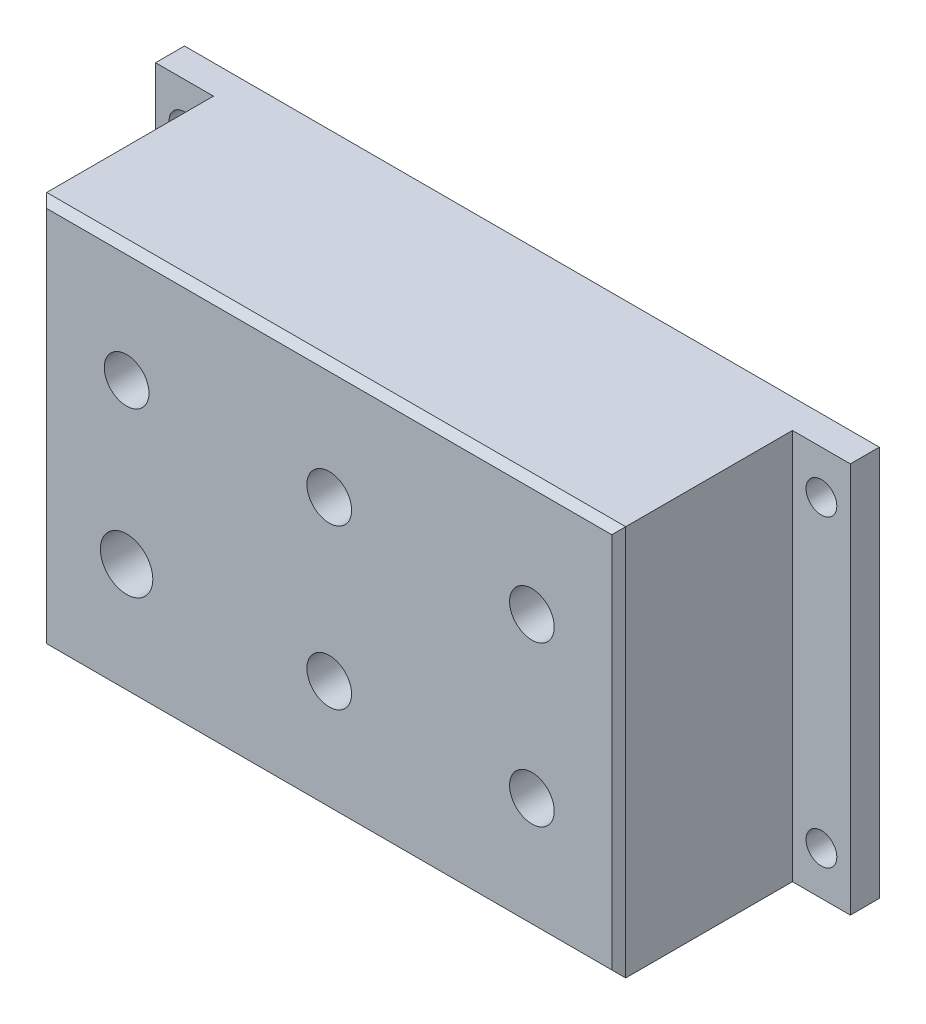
SolidWorks part; units mm, degrees
ref_plane "Front Plane" through (0, 0, 0) normal (0, 0, 1) x (1, 0, 0)
ref_plane "Top Plane" through (0, 0, 0) normal (0, 1, 0) x (1, 0, 0)
ref_plane "Right Plane" through (0, 0, 0) normal (1, 0, 0) x (0, 0, -1)
sketch "Sketch1" plane through (0, 0, 0) normal (0, 0, 1) x (1, 0, 0)
  line L1 (0, 0) -> (152.4, 0)
  line L2 (0, 0) -> (0, 85.725)
  line L3 (0, 85.725) -> (152.4, 85.725)
  line L4 (152.4, 0) -> (152.4, 85.725)
  dimension "D1" = 152.4
  dimension "D2" = 85.725
extrude "body" add sketch "Sketch1" along normal blind 44.45
sketch "Sketch3" plane through (0, 0, 44.45) normal (0, 0, 1) x (1, 0, 0)
  line L0 (0, 0) -> (152.4, 0) construction
  line L1 (0, 85.725) -> (12.7, 85.725)
  line L2 (0, 85.725) -> (0, 0)
  line L3 (0, 0) -> (12.7, 0)
  line L4 (12.7, 85.725) -> (12.7, 0)
  line L6 (152.4, 85.725) -> (139.7, 85.725)
  line L7 (152.4, 85.725) -> (152.4, 0)
  line L8 (152.4, 0) -> (139.7, 0)
  line L9 (139.7, 85.725) -> (139.7, 0)
  dimension "D1" = 12.7
  dimension "D2" = 12.7
extrude "ears" cut sketch "Sketch3" against normal blind 38.1
sketch "Sketch4" plane through (0, 0, 6.35) normal (0, 0, 1) x (1, 0, 0)
  line L0 (146.05, 85.725) -> (146.05, -7.6292) construction
  line L1 (152.4, 85.725) -> (139.7, 85.725) construction
  line L2 (6.35, 85.725) -> (6.35, -3.103) construction
  line L3 (12.7, 85.725) -> (0, 85.725) construction
  line L4 (-8.9064, 76.2) -> (161.3064, 76.2) construction
  line L5 (-8.9064, 9.525) -> (159.9348, 9.525) construction
  circle A0 centre (6.35, 76.2) radius 3.3782
  circle A1 centre (6.35, 9.525) radius 3.3782
  circle A2 centre (146.05, 9.525) radius 3.3782
  circle A3 centre (146.05, 76.2) radius 3.3782
  dimension "D3" = 6.7564
  dimension "D4" = 6.7564
  dimension "D5" = 6.7564
  dimension "D6" = 6.7564
  dimension "D1" = 9.525
  dimension "D2" = 66.675
extrude "mount holes" cut sketch "Sketch4" against normal through all
sketch "Sketch5" plane through (0, 0, 44.45) normal (0, 0, 1) x (1, 0, 0)
  line L0 (-8.7692, 60.325) -> (159.1119, 60.325) construction
  line L1 (-10.4151, 25.4) -> (159.1119, 25.4) construction
  line L2 (139.7, 85.725) -> (12.7, 85.725) construction
  line L3 (12.7, 0) -> (139.7, 0) construction
  line L4 (0, 42.8625) -> (159.1119, 42.8625) construction
  line L5 (0, 85.725) -> (0, 0) construction
  line L6 (31.75, 108.9549) -> (31.75, 11.5729) construction
  line L7 (53.975, 108.9549) -> (53.975, 13.6303) construction
  line L8 (76.2, 108.9549) -> (76.2, 13.3559) construction
  line L9 (98.425, 108.9549) -> (98.425, 11.5729) construction
  line L10 (12.7, 0) -> (12.7, 85.725) construction
  line L11 (120.65, 107.0347) -> (120.65, 11.5729) construction
  line L12 (139.7, 85.725) -> (139.7, 0) construction
  circle A0 centre (31.75, 25.4) radius 5.7531
  circle A2 centre (76.2, 25.4) radius 4.9022
  circle A4 centre (31.75, 60.325) radius 4.9022
  circle A5 centre (76.2, 60.325) radius 4.9022
  circle A6 centre (120.65, 60.325) radius 4.9022
  circle A7 centre (120.65, 25.4) radius 4.9022
  dimension "D9" = 9.8044
  dimension "D11" = 11.5062
  dimension "D12" = 9.8044
  dimension "D13" = 9.8044
  dimension "D15" = 9.8044
  dimension "D16" = 9.8044
  dimension "D1" = 25.4
  dimension "D2" = 25.4
  dimension "D3" = 19.05
  dimension "D4" = 22.225
  dimension "D5" = 22.225
  dimension "D6" = 22.225
  dimension "D7" = 22.225
  dimension "D8" = 19.05
extrude "conn holes" cut sketch "Sketch5" against normal through all
sketch "Sketch6" plane through (0, 0, 0) normal (0, 0, -1) x (-1, 0, 0)
  line L0 (-152.4, 85.725) -> (0, 85.725) construction
  line L1 (-127, 79.375) -> (-25.4, 79.375)
  line L2 (-133.35, 73.025) -> (-133.35, 12.7)
  line L3 (-127, 6.35) -> (-25.4, 6.35)
  line L4 (-19.05, 73.025) -> (-19.05, 12.7)
  line L5 (0, 0) -> (-152.4, 0) construction
  line L6 (-139.7, 85.725) -> (-139.7, 0) construction
  line L7 (-12.7, 0) -> (-12.7, 85.725) construction
  arc A0 (-133.35, 73.025) -> (-127, 79.375) centre (-127, 73.025) cw
  arc A1 (-127, 6.35) -> (-133.35, 12.7) centre (-127, 12.7) cw
  arc A2 (-25.4, 6.35) -> (-19.05, 12.7) centre (-25.4, 12.7) ccw
  arc A3 (-19.05, 73.025) -> (-25.4, 79.375) centre (-25.4, 73.025) ccw
  dimension "D5" = 6.35
  dimension "D1" = 6.35
  dimension "D2" = 6.35
  dimension "D3" = 6.35
  dimension "D4" = 6.35
extrude "Cut-Extrude4" cut sketch "Sketch6" against normal blind 28.575
chamfer "Chamfer1" distance 1.524 angle 45 4 edges at (76.2, 0, 44.45) (139.7, 42.8625, 44.45) (76.2, 85.725, 44.45) (12.7, 42.8625, 44.45)
sketch "Sketch7" plane through (12.7, 0, 0) normal (-1, 0, 0) x (0, 0, 1)
  line L0 (44.45, 42.8625) -> (-7.473, 42.8625) construction
  line L1 (44.45, 84.201) -> (44.45, 1.524) construction
  line L2 (21.844, 106.9602) -> (21.844, -4.5629) construction
  line L3 (6.35, 85.725) -> (6.35, 0) construction
  point P6 (21.844, 42.8625)
  dimension "D2" = 15.494
hole_wizard "1/2 NPT Tapped Hole1" positions "3DSketch1" profile "Sketch9" size "1/2" standard "Ansi Inch"
sketch3d "3DSketch1"
  point P0 (12.7, 42.8625, 21.844)
sketch "Sketch9" plane through (12.7, 42.8625, 21.844) normal (0, 1, 0) x (0, 0, 1)
  line L0 (0, 0) -> (0, 27.9705)
  line L1 (8.9281, 22.606) -> (0, 27.9705)
  line L2 (-8.9281, 22.606) -> (0, 27.9705) construction
  line L3 (8.9281, 22.606) -> (8.9281, 13.462)
  line L4 (8.9281, 13.462) -> (9.4797, 13.462)
  line L5 (9.4797, 13.462) -> (9.8828, 0)
  line L6 (-9.4797, 13.462) -> (-9.8828, 0) construction
  line L7 (9.8828, 0) -> (0, 0)
  line L8 (0, -6.35) -> (0, 107.95) construction
  line L11 (-8.9281, 13.462) -> (-9.4797, 13.462) construction
  dimension "Tap Drill Dia." = 17.8562
  dimension "Tap Drill Depth" = 22.606
  dimension "Thread Dia." = 19.7656
  dimension "Thread Angle" = 3.43
  dimension "Thread Depth" = 13.462
  dimension "Drill Angle" = 118
